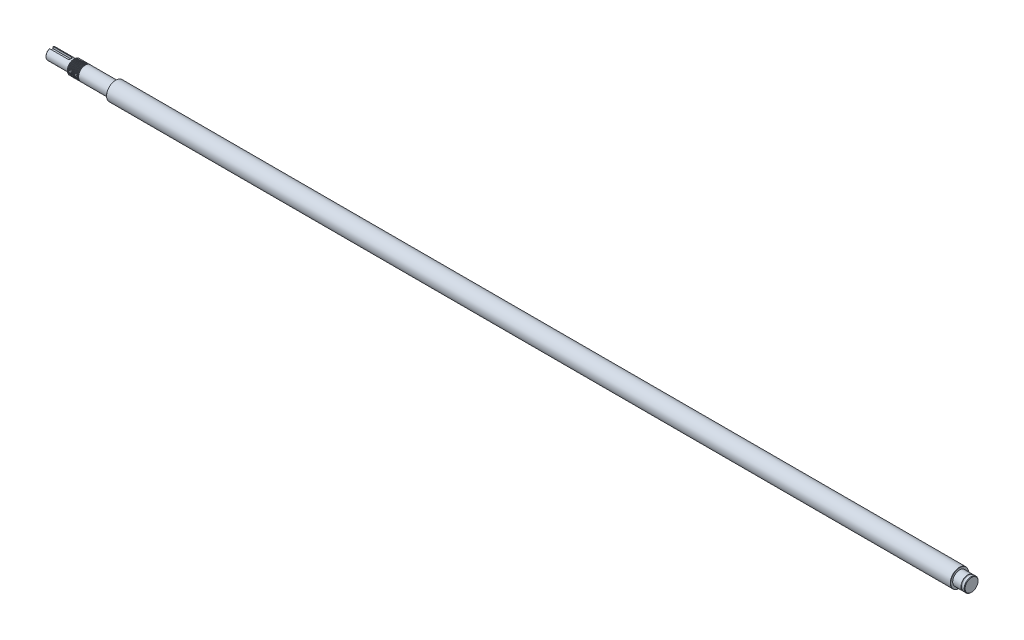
SolidWorks part; units mm, degrees
ref_plane "Front Plane" through (0, 0, 0) normal (0, 0, 1) x (1, 0, 0)
ref_plane "Top Plane" through (0, 0, 0) normal (0, 1, 0) x (1, 0, 0)
ref_plane "Right Plane" through (0, 0, 0) normal (1, 0, 0) x (0, 0, -1)
sketch "Sketch1" plane through (0, 0, 0) normal (0, 0, 1) x (1, 0, 0)
  line L0 (-50.248, 0) -> (-50.248, 6)
  line L1 (-50.248, 6) -> (-25.248, 6)
  line L2 (-25.248, 6) -> (-25.248, 7.5)
  line L3 (-25.248, 7.5) -> (19.752, 7.5)
  line L4 (19.752, 7.5) -> (19.752, 9.9)
  line L5 (19.752, 9.9) -> (936.752, 9.9)
  line L6 (936.752, 9.9) -> (936.752, 7.5)
  line L7 (936.752, 7.5) -> (945.752, 7.5)
  line L8 (945.752, 7.5) -> (945.752, 7.15)
  line L9 (945.752, 7.15) -> (946.902, 7.15)
  line L10 (946.902, 7.15) -> (946.902, 7.5)
  line L11 (946.902, 7.5) -> (949.752, 7.5)
  line L12 (949.752, 7.5) -> (949.752, 0)
  line L13 (949.752, 0) -> (-50.248, 0)
  point P2 (-25.248, 6.75)
  dimension "D1" = 6
  dimension "D2" = 7.5
  dimension "D3" = 9.9
  dimension "D4" = 7.5
  dimension "D5" = 7.15
  dimension "D6" = 25
  dimension "D7" = 45
  dimension "D8" = 917
  dimension "D9" = 13
  dimension "D10" = 1.15
  dimension "D11" = 10.15
revolve "Revolve1" add sketch "Sketch1" angle 360 about L13
chamfer "Chamfer1" distance 0.5 angle 45 2 edges at (949.752, 7.5, 0) (-50.248, 6, 0)
chamfer "Chamfer2" distance 0.2 angle 45 3 edges at (19.752, 9.9, 0) (-25.248, 7.5, 0) (936.752, 9.9, 0)
ref_plane "Plane1" through (0, 6, 0) normal (0, 1, 0) x (1, 0, 0)
sketch "Sketch2" plane through (0, 6, 0) normal (0, 1, 0) x (1, 0, 0)
  line L0 (-50.248, 0) -> (-30.248, 0) construction
  line L1 (-50.248, 5.5) -> (-50.248, -5.5) construction
  line L2 (-50.248, 2) -> (-30.248, 2)
  line L3 (-50.248, -2) -> (-30.248, -2)
  arc A0 (-50.248, 2) -> (-50.248, -2) centre (-50.248, 0) ccw
  arc A1 (-30.248, -2) -> (-30.248, 2) centre (-30.248, 0) ccw
  point P5 (-40.248, 0)
  dimension "D1" = 20
  dimension "D2" = 4
extrude "Cut-Extrude1" cut sketch "Sketch2" against normal blind 2.5
thread "Thread1" pitch 0.8 start angle 0, offset 0, length 12, pitch 1, diameter 15
ref_plane "Plane2" through (-25.048, 0, -7.5) normal (0, -1, 0) x (0, 0, -1)
sketch "Thread Profile1" plane through (-25.048, 0, -7.5) normal (0, -1, 0) x (0, 0, -1)
  line L0 (0, 0) -> (0, 0.8) construction
  line L11 (0, 0) -> (0, 0.7)
  line L12 (0, 0.7) -> (-0.433, 0.45)
  line L13 (-0.433, 0.45) -> (-0.433, 0.25)
  line L15 (-0.433, 0.25) -> (0, 0)
  line L17 (-0.433, 0.35) -> (0, 0.35) construction
  point P2 (0, 0)
  dimension "Pitch" = 0.8
  dimension "Profile_Angle" = 60
  dimension "Profile_Land" = 0.2
  dimension "Profile_Height" = 0.433
